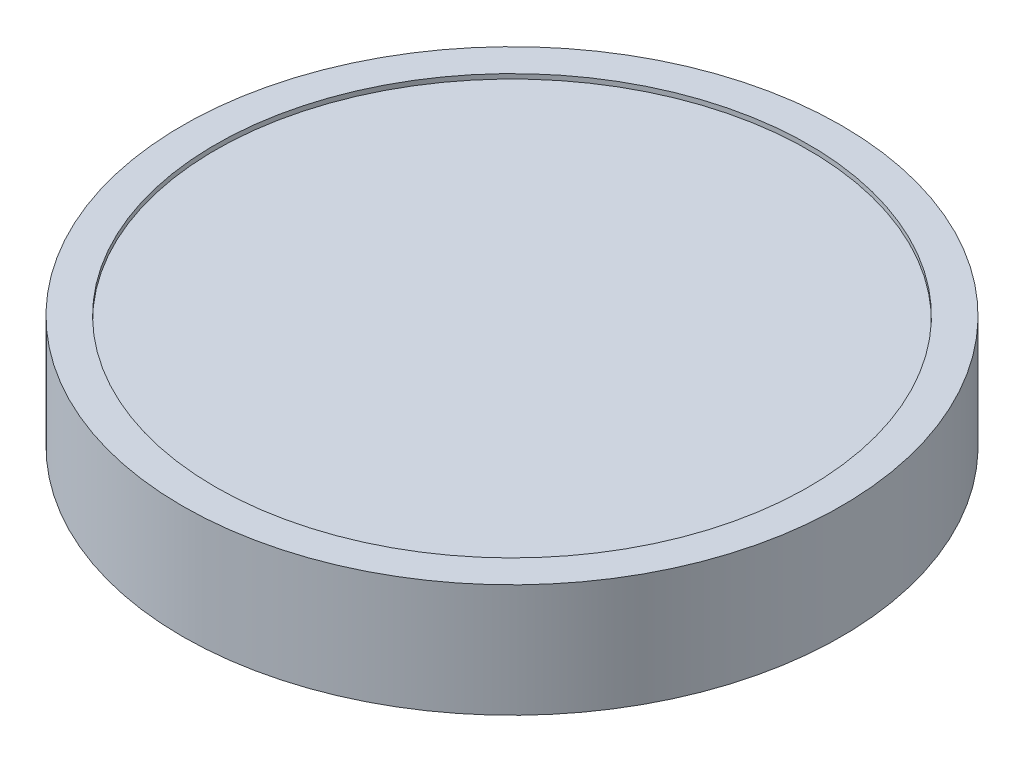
SolidWorks part; units mm, degrees
ref_plane "Alzado" through (0, 0, 0) normal (0, 0, 1) x (1, 0, 0)
ref_plane "Planta" through (0, 0, 0) normal (0, 1, 0) x (1, 0, 0)
ref_plane "Vista lateral" through (0, 0, 0) normal (1, 0, 0) x (0, 0, -1)
sketch "Croquis1" plane through (0, 0, 0) normal (0, 1, 0) x (1, 0, 0)
  circle A0 centre (0, 0) radius 70
  dimension "D1" = 140
extrude "Saliente-Extruir1" add sketch "Croquis1" along normal blind 24
sketch "Croquis2" plane through (0, 24, 0) normal (0, 1, 0) x (1, 0, 0)
  circle A0 centre (0, 0) radius 63
  circle A1 centre (0, 0) radius 70 construction
  dimension "D1" = 7
extrude "Cortar-Extruir1" cut sketch "Croquis2" against normal blind 1
